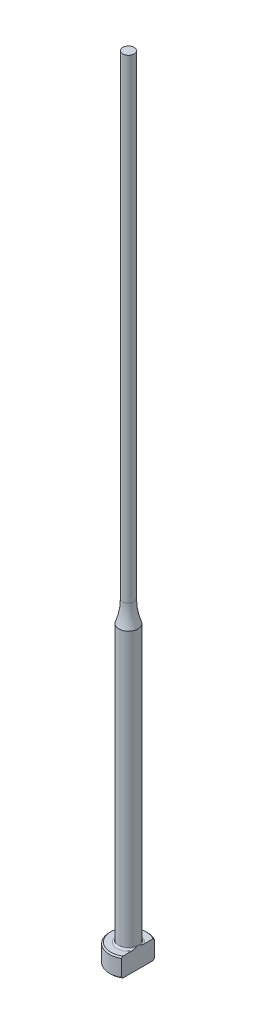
SolidWorks part; units mm, degrees
ref_plane "Front Plane" through (0, 0, 0) normal (0, 0, 1) x (1, 0, 0)
ref_plane "Top Plane" through (0, 0, 0) normal (0, 1, 0) x (1, 0, 0)
ref_plane "Right Plane" through (0, 0, 0) normal (1, 0, 0) x (0, 0, -1)
sketch "Sketch1" plane through (0, 0, 0) normal (0, 0, 1) x (1, 0, 0)
  line L0 (0, 259.9588) -> (0, -15.1925) construction
  line L1 (0, 0) -> (-3, 0)
  line L2 (-3, 0) -> (-3, 3)
  line L3 (-3, 3) -> (-1.5, 3)
  line L4 (-0.9, 50) -> (-0.9, 125)
  line L5 (-0.9, 125) -> (0, 125)
  line L6 (0, 125) -> (0, 0)
  line L7 (-1.5, 3) -> (-1.5, 46.5883)
  arc A0 (-1.5, 46.5883) -> (-0.9, 50) centre (-10.9, 50) ccw
  point P13 (-1.5, 0)
  dimension "D1" = 10
  dimension "L" = 125
  dimension "H" = 6
  dimension "T" = 3
  dimension "D" = 1.8
  dimension "B" = 3
  dimension "S" = 50
revolve "Revolve1" add sketch "Sketch1" angle 360 about L0
chamfer "Chamfer1" distance 0.2 angle 45 2 edges at (0, 3, 3) (0, 0, 3)
fillet "Fillet1" radius 0.3 1 edges at (0, 3, 1.5)
sketch "Sketch2" plane through (0, 0, 0) normal (0, 1, 0) x (1, 0, 0)
  line L0 (1.5, 2.5981) -> (1.5, -2.5981)
  circle A0 centre (0, 0) radius 3 construction
  arc A1 (1.5, -2.5981) -> (1.5, 2.5981) centre (0, 0) ccw
  circle A2 centre (0, 0) radius 1.5 construction
extrude "KEY" cut sketch "Sketch2" along normal through all
